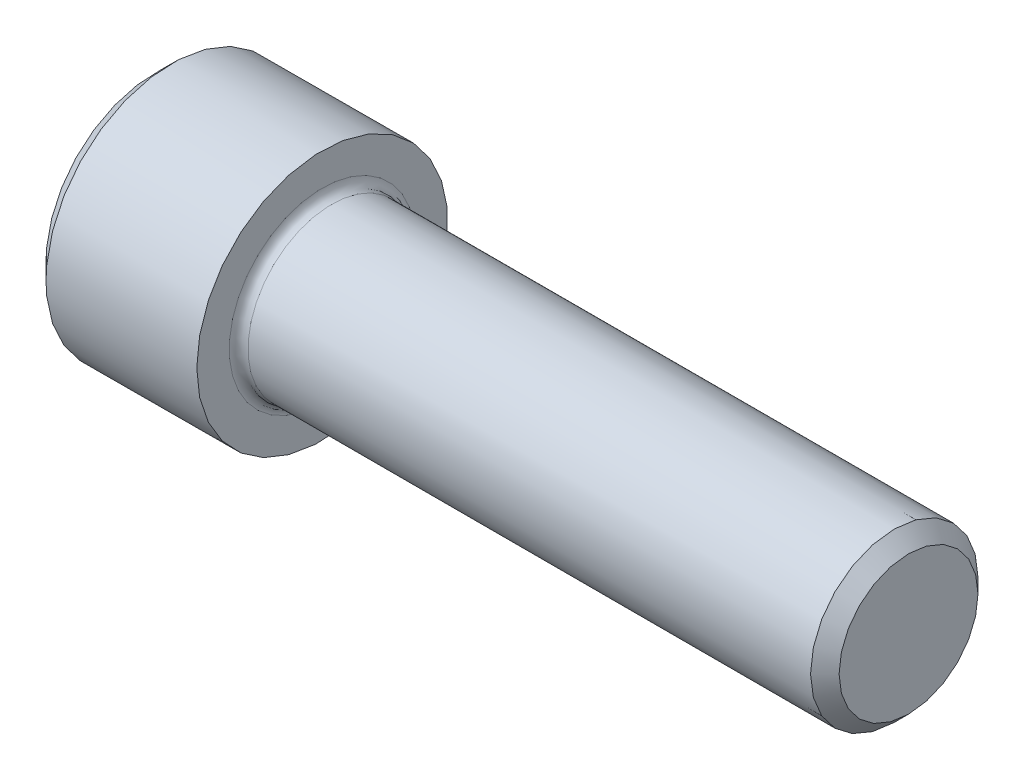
SolidWorks part; units mm, degrees
ref_plane "Plane1" through (0, 0, 0) normal (0, 0, 1) x (1, 0, 0)
ref_plane "Plane2" through (0, 0, 0) normal (0, 1, 0) x (1, 0, 0)
ref_plane "Plane3" through (0, 0, 0) normal (1, 0, 0) x (0, 0, -1)
revolve "Base-Revolve" add sketch "BodySke"
sketch "BodySke" plane through (0, 0, 0) normal (0, 0, 1) x (1, 0, 0)
  line L0 (0, 0) -> (0, 4.1275)
  line L1 (0.635, 4.7625) -> (6.35, 4.7625)
  line L2 (6.35, 4.7625) -> (6.35, 3.175)
  line L3 (6.35, 3.175) -> (30.9943, 3.175)
  line L4 (31.75, 2.4193) -> (31.75, 0)
  line L5 (31.75, 0) -> (0, 0)
  line L6 (-31.75, 0) -> (127, 0) construction
  line L7 (0, 4.1275) -> (0.635, 4.7625)
  line L8 (31.75, 2.4193) -> (30.9943, 3.175)
  line L9 (0, -4.1275) -> (0.635, -4.7625) construction
  line L10 (31.75, -2.4193) -> (30.9943, -3.175) construction
  line L11 (7.62, 9.525) -> (7.62, 3.175) construction
  line L12 (6.35, 9.525) -> (6.35, 3.175) construction
  line L13 (-6.35, 9.525) -> (-6.35, 3.175) construction
  dimension "Diameter" = 6.35
  dimension "Head_ht" = 6.35
  dimension "Length" = 25.4
  dimension "Body_ch_ang" = 45
  dimension "Head_dia" = 9.525
  dimension "Head_ch_ang" = 45
  dimension "Head_side_ht" = 5.715
  dimension "Minor_dia" = 4.8387
  dimension "Advance" = 1.27
  dimension "Thread_nom" = 25.4
  dimension "Thread_length" = 38.1
fillet "Fillet1" radius 0.3556 1 edges at (6.35, 0, 3.175)
sketch "Sketch2" plane through (0, 0, 0) normal (0, 0, 1) x (1, 0, 0)
  line L0 (0, 2.3812) -> (3.048, 2.3812)
  line L1 (3.048, 2.3812) -> (4.4228, 0)
  line L2 (-31.75, 0) -> (127, 0) construction
  line L3 (4.4228, 0) -> (0, 0)
  line L4 (0, 0) -> (0, 2.3812)
  line L5 (0, 4.1275) -> (0, -4.1275) construction
  line L6 (0, 0) -> (47.625, 0) construction
  line L7 (6.35, -4.7625) -> (6.35, 4.7625) construction
  dimension "D1" = 2.3813
  dimension "D2" = 60
  dimension "Wall_thickness" = 3.302
revolve "Hex-PreBroach" cut sketch "Sketch2" angle 360 about L6
sketch "Sketch3" plane through (0, 0, 0) normal (-1, 0, 0) x (0, 0.5, 0.866)
  line L0 (1.3748, 2.3813) -> (-1.3748, 2.3813)
  line L1 (-1.3748, 2.3813) -> (-2.7496, 0)
  line L2 (1.3748, 2.3813) -> (2.7496, 0)
  line L3 (1.3748, -2.3812) -> (2.7496, 0)
  line L4 (1.3748, -2.3812) -> (-1.3748, -2.3812)
  line L5 (-1.3748, -2.3812) -> (-2.7496, 0)
  dimension "D1" = 2.3813
  dimension "D2" = 2.3813
  dimension "Hex_size" = 4.7625
extrude "Hex" cut sketch "Sketch3" against normal blind 3.048
sketch "Sketch4" plane through (0, 0, 0) normal (-1, 0, 0) x (0, 0, 1)
  line L0 (0, 0) -> (2.8067, 0)
  line L1 (0, 0) -> (6.1484, 3.5498) construction
  line L2 (0, 0) -> (1.4033, 2.4307)
  line L3 (2.3336, 0.614) -> (2.6851, 0.817)
  line L4 (1.6986, 1.7139) -> (2.0501, 1.9169)
  arc A0 (2.3336, 0.614) -> (1.6986, 1.7139) centre (0, 0) ccw
  arc A1 (2.8067, 0) -> (2.6851, 0.817) centre (0, 0) ccw
  arc A2 (1.4033, 2.4307) -> (2.0501, 1.9169) centre (0, 0) cw
  dimension "D1" = 30
  dimension "Spline_n_dim" = 4.826
  dimension "Spline_m_dim" = 5.6134
  dimension "D2" = 60
  dimension "D3" = 0.635
  dimension "Spline_p_dim" = 1.27
extrude "Spline" cut sketch "Sketch4" against normal blind 3.048
pattern_circular "CirPattern1" count 6 every 60
sketch "Sketch5" plane through (0, 0, 0) normal (0, 0, 1) x (1, 0, 0)
  line L0 (-31.75, 0) -> (127, 0) construction
  line L2 (0, 4.1275) -> (0, -4.1275) construction
  circle A0 centre (2.159, 0) radius 0.5905
  dimension "Drilled_hole_dia" = 1.1811
  dimension "Drilled_hole_loc" = 2.159
extrude "Hole" cut sketch "Sketch5" against normal through all and the other way through all
pattern_circular "Drilled-4" count 2 every 60
pattern_circular "Drilled-6" count 3 every 60
sketch "ThdSchSke" plane through (0, 0, 0) normal (0, 0, 1) x (1, 0, 0)
  line L0 (7.62, -2.4194) -> (7.0909, -3.175)
  line L1 (7.62, -2.4194) -> (8.1491, -3.175)
  line L2 (8.1491, -3.175) -> (8.1491, -3.9688)
  line L3 (-3.175, 0) -> (5.1513, 0) construction
  line L5 (8.1491, -3.9688) -> (7.0909, -3.9688)
  line L6 (7.0909, -3.9688) -> (7.0909, -3.175)
  line L7 (0, 4.1275) -> (0, -4.1275) construction
  dimension "Thread_minor" = 4.8387
  dimension "Diameter" = 6.35
  dimension "Start" = 7.62
  dimension "SideAngle" = 55
  dimension "VeeAngle" = 70
  dimension "Overcut" = 7.9375
revolve "ThreadSchematic" cut sketch "ThdSchSke" angle 360 about L3
pattern_linear "ThdSchPat"
equation "\"D2@Sketch3\" = \"Hex_size@Sketch3\" / 2"
equation "\"D1@Sketch3\" = \"Hex_size@Sketch3\" / 2"
equation "\"D1@Sketch2\" = \"Hex_size@Sketch3\" / 2"
equation "\"D3@Sketch4\" = \"Spline_p_dim@Sketch4\" / 2"
equation "\"Thread_minor@ThreadCosmetic\"  =  \"Minor_dia@BodySke\""
equation "\"D2@CirPattern1\" = 360 / \"Num_teeth@CirPattern1\""
equation "\"Wall_thickness@Sketch2\" = \"Head_ht@BodySke\" - \"Key_eng@Hex\""
equation "\"Thread_length@ThreadCosmetic\" = ((sgn( (\"Length@BodySke\" - \"Advance@BodySke\" ) - \"Thread_nom@BodySke\" )-1)*( (\"Length@BodySke\" - \"Advance@BodySke\" ) - \"Thread_nom@BodySke\" ))/-2+ \"Thread_nom@BodySke\""
equation "\"Thread_minor@ThdSchSke\" = \"Minor_dia@BodySke\""
equation "\"Diameter@ThdSchSke\" = \"Diameter@BodySke\""
equation "\"Overcut@ThdSchSke\" = \"Diameter@BodySke\" * 1.25"
equation "\"Start@ThdSchSke\" = \"Head_ht@BodySke\" + \"Length@BodySke\" - \"Thread_length@ThreadCosmetic\"  '---Non-countersunk---"
equation "\"Num_threads@ThdSchPat\" = int( \"Thread_length@ThreadCosmetic\" / \"Advance@BodySke\" + 0.999 )  + 1"
equation "\"Advance@ThdSchPat\" = \"Thread_length@ThreadCosmetic\" /  (\"Num_threads@ThdSchPat\" - 1) 'relax it"
equation "\"Num_threads@ThdSchPat\" = \"Num_threads@ThdSchPat\" - sgn( \"Num_threads@ThdSchPat\" - 1) '---chamfered tips only---"
